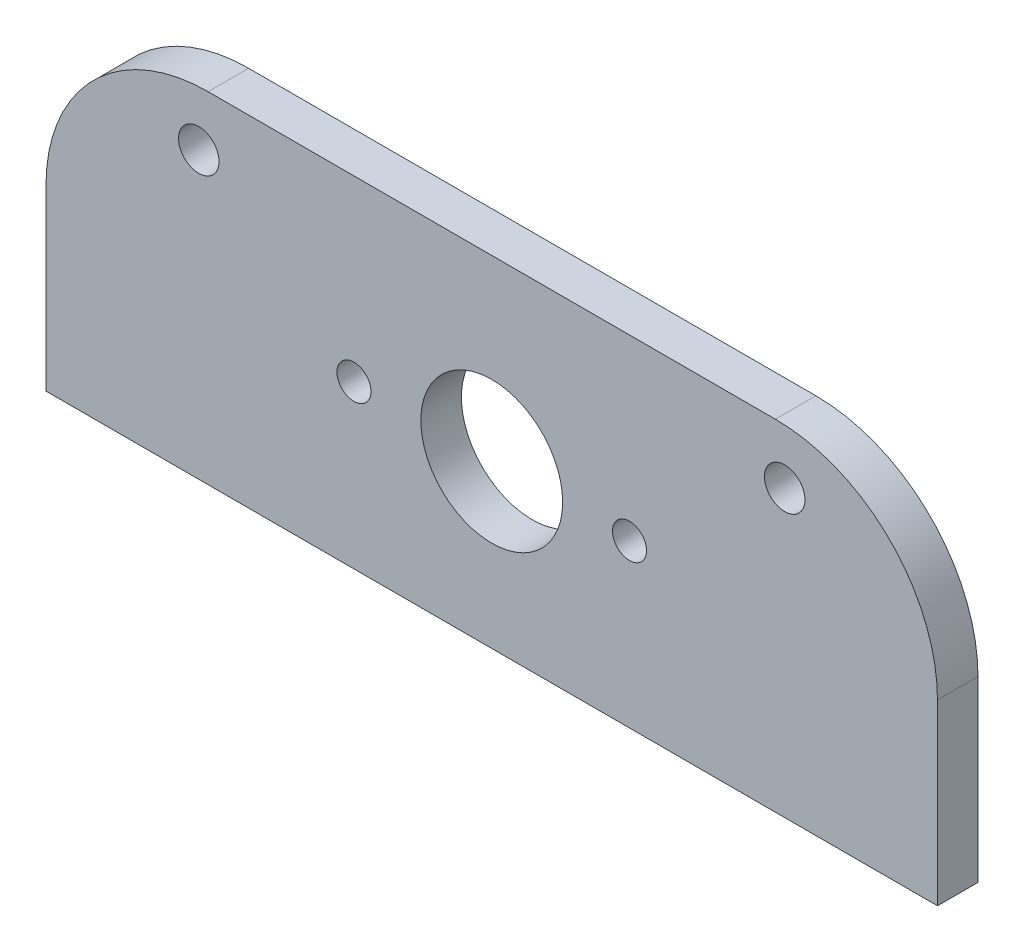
SolidWorks part; units mm, degrees
ref_plane "Front" through (0, 0, 0) normal (0, 0, 1) x (1, 0, 0)
ref_plane "Top" through (0, 0, 0) normal (0, 1, 0) x (1, 0, 0)
ref_plane "Right" through (0, 0, 0) normal (1, 0, 0) x (0, 0, -1)
sketch "Esquisse1" plane through (0, 0, 0) normal (0, 0, 1) x (1, 0, 0)
  line L0 (-55, 0) -> (55, 0) construction
  line L1 (0, 22) -> (0, -20) construction
  line L2 (-55, 22) -> (55, 22)
  line L3 (-55, 22) -> (-55, -20)
  line L4 (-55, -20) -> (55, -20)
  line L5 (55, 22) -> (55, -20)
  line L6 (-55, 15.2) -> (55, 15.2) construction
  circle A0 centre (0, 0) radius 8.75
  circle A1 centre (-36.15, 15.2) radius 2.5
  circle A2 centre (36.15, 15.2) radius 2.5
  dimension "D1" = 110
  dimension "D2" = 20
  dimension "D4" = 17.5
  dimension "D6" = 5
  dimension "D7" = 5
  dimension "D8" = 36.15
  dimension "D9" = 36.15
  dimension "D3" = 22
  dimension "D5" = 15.2
extrude "Boss.-Extru.1" add sketch "Esquisse1" along normal mid plane 5
fillet "Congé1" radius 20 2 edges at (55, 22, 0) (-55, 22, 0)
hole_wizard "Diamètre du perçage Ø4.0 (4)1" positions "Esquisse2" profile "Esquisse3" hole size "Ø4.0" standard "ISO"
sketch "Esquisse2" plane through (0, -20, 0) normal (0, -1, 0) x (-1, 0, 0)
  line L0 (55, 0) -> (-55, 0) construction
  point P0 (-20, 0)
  point P4 (20, 0)
  dimension "D1" = 20
  dimension "D2" = 20
sketch "Esquisse3" plane through (20, -20, 0) normal (1, 0, 0) x (0, 0, -1)
  line L0 (0, 0) -> (0, 5.2017)
  line L1 (0, 5.2017) -> (2, 4)
  line L2 (2, 4) -> (2, 0)
  line L5 (2, 0) -> (0, 0)
  line L10 (0, 5.2017) -> (-2, 4) construction
  line L11 (0, -6.35) -> (0, 107.95) construction
  dimension "Diamètre du perçage" = 4
  dimension "Profondeur du perçage" = 4
  dimension "Angle de pointe" = 118
hole_wizard "Trou taraudé M41" positions "Esquisse6" profile "Esquisse7" tap size "M4" standard "ISO"
sketch "Esquisse6" plane through (0, -20, 0) normal (0, -1, 0) x (-1, 0, 0)
  line L0 (55, 0) -> (-55, 0) construction
  point P0 (-33.5, 0)
  point P4 (33.5, 0)
  dimension "D1" = 33.5
  dimension "D2" = 33.5
sketch "Esquisse7" plane through (33.5, -20, 0) normal (1, 0, 0) x (0, 0, -1)
  line L0 (0, 0) -> (0, 12.4914)
  line L1 (0, 12.4914) -> (1.65, 11.5)
  line L2 (1.65, 11.5) -> (1.65, 0)
  line L5 (1.65, 0) -> (0, 0)
  line L10 (0, 12.4914) -> (-1.65, 11.5) construction
  line L11 (0, -6.35) -> (0, 107.95) construction
  dimension "Diamètre du trou pour taraudage" = 3.3
  dimension "Profondeur du trou pour taraudage" = 11.5
  dimension "Angle de pointe" = 118
hole_wizard "Trou taraudé M51" positions "Esquisse8" profile "Esquisse9" tap size "M5" standard "ISO"
sketch "Esquisse8" plane through (0, 0, 2.5) normal (0, 0, 1) x (1, 0, 0)
  line L0 (-55, 0) -> (55, 0) construction
  circle A0 centre (0, 0) radius 8.75 construction
  point P0 (-17, 0)
  point P4 (17, 0)
  dimension "D1" = 17
  dimension "D2" = 17
sketch "Esquisse9" plane through (-17, 0, 2.5) normal (1, 0, 0) x (0, -1, 0)
  line L0 (0, 0) -> (0, 5)
  line L1 (0, 5) -> (2.1, 5)
  line L2 (2.1, 5) -> (2.1, 0)
  line L5 (2.1, 0) -> (0, 0)
  line L11 (0, -6.35) -> (0, 107.95) construction
  dimension "Diamètre du trou pour taraudage jusqu'au prochain" = 4.2
  dimension "Profondeur du trou pour taraudage jusqu'au prochain" = 5
